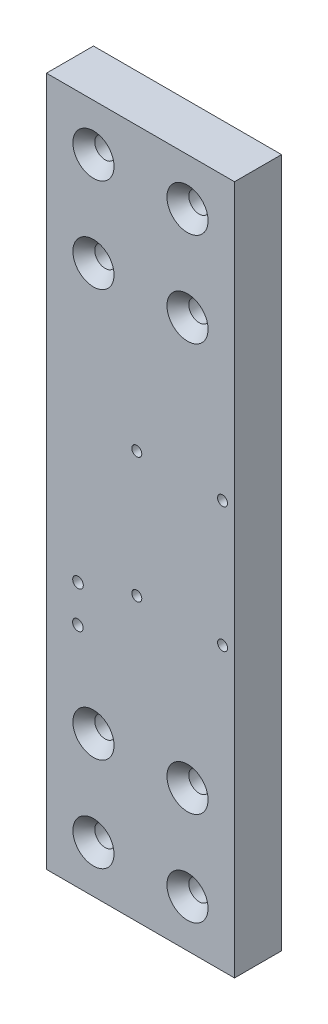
SolidWorks part; units mm, degrees
ref_plane "Front Plane" through (0, 0, 0) normal (0, 0, 1) x (1, 0, 0)
ref_plane "Top Plane" through (0, 0, 0) normal (0, 1, 0) x (1, 0, 0)
ref_plane "Right Plane" through (0, 0, 0) normal (1, 0, 0) x (0, 0, -1)
sketch "Sketch1" plane through (0, 0, 0) normal (0, 0, 1) x (1, 0, 0)
  line L1 (38.1, -139.7) -> (-38.1, -139.7)
  line L2 (38.1, -139.7) -> (38.1, 139.7)
  line L3 (38.1, 139.7) -> (-38.1, 139.7)
  line L4 (-38.1, -139.7) -> (-38.1, 139.7)
  line L5 (38.1, -139.7) -> (-38.1, 139.7) construction
  line L6 (38.1, 139.7) -> (-38.1, -139.7) construction
  point P0 (0, 0)
  dimension "D1" = 76.2
  dimension "D2" = 279.4
extrude "Extrude1" add sketch "Sketch1" along normal blind 19.05
hole_wizard "CSK for 5/16 Flat Head Socket Cap Screw1" positions "3DSketch1" profile "Sketch2" countersink size "5/16" standard "Ansi Inch"
sketch3d "3DSketch1"
  line L0 (-38.1, -139.7, 19.05) -> (38.1, -139.7, 19.05) construction
  line L1 (-38.1, 139.7, 19.05) -> (-38.1, -139.7, 19.05) construction
  point P0 (-19.05, -120.65, 19.05)
  dimension "D1" = 19.05
  dimension "D2" = 19.05
sketch "Sketch2" plane through (-19.05, -120.65, 19.05) normal (1, 0, 0) x (0, -1, 0)
  line L0 (0, 0) -> (0, 19.05)
  line L1 (0, 19.05) -> (4.2164, 19.05)
  line L2 (4.2164, 19.05) -> (4.2164, 4.7335)
  line L3 (4.2164, 4.7335) -> (8.3312, 0)
  line L5 (8.3312, 0) -> (0, 0)
  line L6 (-4.2164, 4.7335) -> (-8.3312, 0) construction
  line L11 (0, -6.35) -> (0, 107.95) construction
  dimension "Thru Hole Dia." = 8.4328
  dimension "Thru Hole Depth" = 19.05
  dimension "Near C'Sink Dia." = 16.6624
  dimension "Near C'Sink Angle" = 82
pattern_linear "LPattern1" count 2 spacing 38.1 along (0, 1, 0) count 2 spacing 38.1 along (1, 0, 0) of "CSK for 5/16 Flat Head Socket Cap Screw1"
mirror "Mirror1" about plane through (0, 0, 0) normal (0, 1, 0) of "LPattern1", "CSK for 5/16 Flat Head Socket Cap Screw1"
sketch "Sketch3" plane through (0, 0, 19.05) normal (0, 0, 1) x (1, 0, 0)
  line L0 (-38.1, 139.7) -> (-38.1, -139.7) construction
  point P0 (-38.1, 0)
ref_plane "Plane1" through (0, 0, 0) normal (0, 1, 0) x (-1, 0, 0)
sketch "Sketch4" plane through (0, 0, 0) normal (0, 0, -1) x (-1, 0, 0)
  line L0 (38.1, 0) -> (-38.1, 0) construction
  line L1 (38.1, 139.7) -> (38.1, -139.7) construction
  line L2 (-38.1, -139.7) -> (-38.1, 139.7) construction
  line L3 (38.1, 25.4) -> (-38.1, 25.4)
  line L4 (38.1, -25.4) -> (-38.1, -25.4)
  line L5 (0, 139.7) -> (0, -139.7) construction
  line L6 (-38.1, 139.7) -> (38.1, 139.7) construction
  line L7 (38.1, -139.7) -> (-38.1, -139.7) construction
  line L8 (-38.1, -139.7) -> (-38.1, 139.7)
  line L9 (-33.2486, -139.7) -> (-33.2486, 139.7)
  line L10 (1.4986, -139.7) -> (1.4986, 139.7)
  point P20 (1.4986, 25.4)
  point P21 (1.4986, 0)
  point P22 (1.4986, -25.4)
  point P23 (-33.2486, -25.4)
  point P24 (-33.2486, 25.4)
  dimension "D1" = 25.4
  dimension "D2" = 25.4
  dimension "D3" = 4.8514
  dimension "D4" = 34.7472
hole_wizard "#10-32 Tapped Hole1" positions "3DSketch3" profile "Sketch7" tap size "#10-32" standard "Ansi Inch"
sketch3d "3DSketch3"
  point P0 (-1.4986, 25.4, 0)
  point P3 (33.2486, 25.4, 0)
  point P6 (-1.4986, -25.4, 0)
  point P9 (33.2486, -25.4, 0)
sketch "Sketch7" plane through (-1.4986, 25.4, 0) normal (1, 0, 0) x (0, 1, 0)
  line L0 (0, 0) -> (0, 19.05)
  line L1 (0, 19.05) -> (2.0193, 19.05)
  line L2 (2.0193, 19.05) -> (2.0193, 0)
  line L5 (2.0193, 0) -> (0, 0)
  line L11 (0, -6.35) -> (0, 107.95) construction
  dimension "Thru Tap Drill Dia." = 4.0386
  dimension "Thru Tap Drill Depth" = 19.05
sketch "Sketch8" plane through (0, 0, 19.05) normal (0, 0, 1) x (1, 0, 0)
  circle A0 centre (-25.4, -32.6178) radius 1.7526 construction
  circle A1 centre (-25.4, -32.6178) radius 1.7526
  circle A2 centre (-25.4, -47.6315) radius 1.7526 construction
  circle A3 centre (-25.4, -47.6315) radius 1.7526
hole_wizard "#6 Clearance Hole1" positions "3DSketch4" profile "Sketch9" hole size "#6" standard "Ansi Inch"
sketch3d "3DSketch4"
  point P0 (-25.3202, -32.5656, 19.05)
  point P7 (-25.3794, -47.5777, 19.05)
sketch "Sketch9" plane through (-25.3202, -32.5656, 19.05) normal (1, 0, 0) x (0, -1, 0)
  line L0 (0, 0) -> (0, 19.05)
  line L1 (0, 19.05) -> (2.1526, 19.05)
  line L2 (2.1526, 19.05) -> (2.1526, 0)
  line L5 (2.1526, 0) -> (0, 0)
  line L11 (0, -6.35) -> (0, 107.95) construction
  dimension "Thru Hole Dia." = 4.3053
  dimension "Thru Hole Depth" = 19.05
